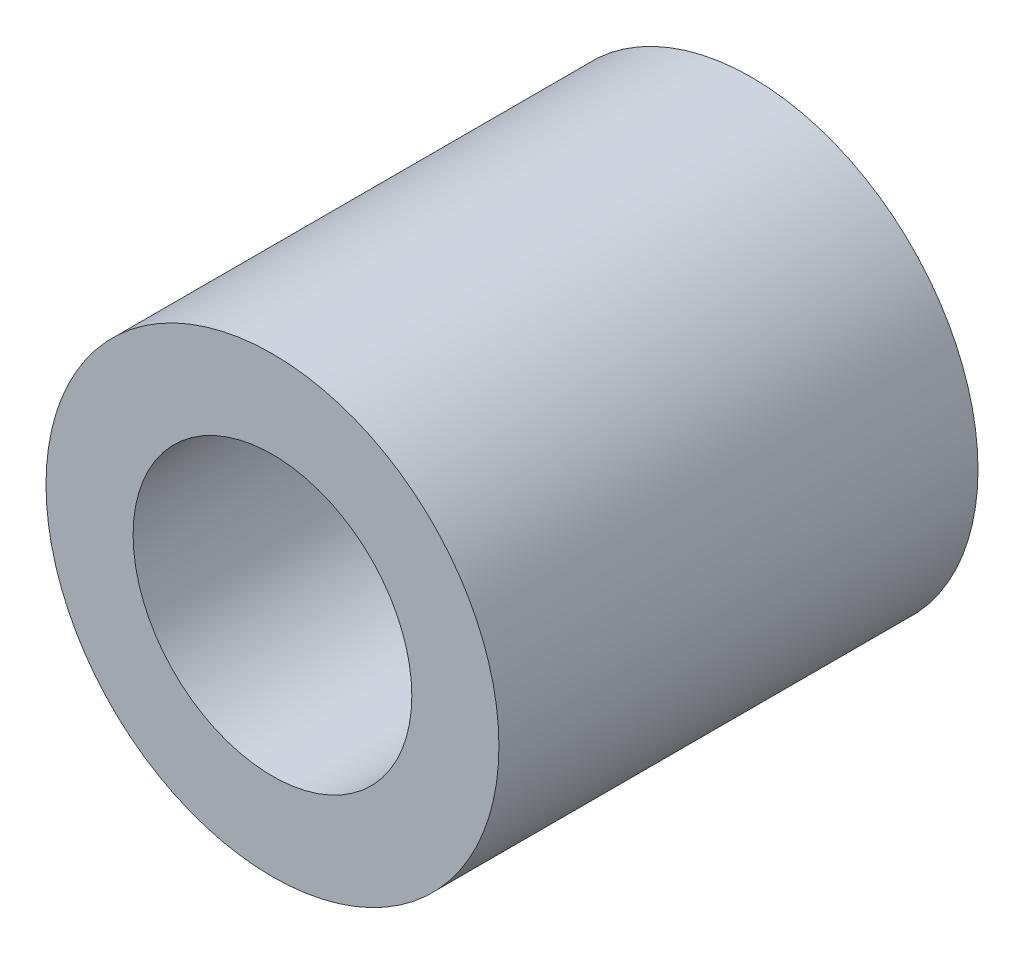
SolidWorks part; units mm, degrees
ref_plane "Plan de face" through (0, 0, 0) normal (0, 0, 1) x (1, 0, 0)
ref_plane "Plan de dessus" through (0, 0, 0) normal (0, 1, 0) x (1, 0, 0)
ref_plane "Plan de droite" through (0, 0, 0) normal (1, 0, 0) x (0, 0, -1)
sketch "Esquisse1" plane through (0, 0, -5) normal (0, 0, 1) x (1, 0, 0)
  circle A0 centre (468.4679, -125) radius 8 construction
  circle A1 centre (468.4679, -125) radius 8
  circle A2 centre (468.4679, -125) radius 13
  dimension "D1" = 5
extrude "Extrusion2" add sketch "Esquisse1" against normal up to surface (27.5 mm away)
